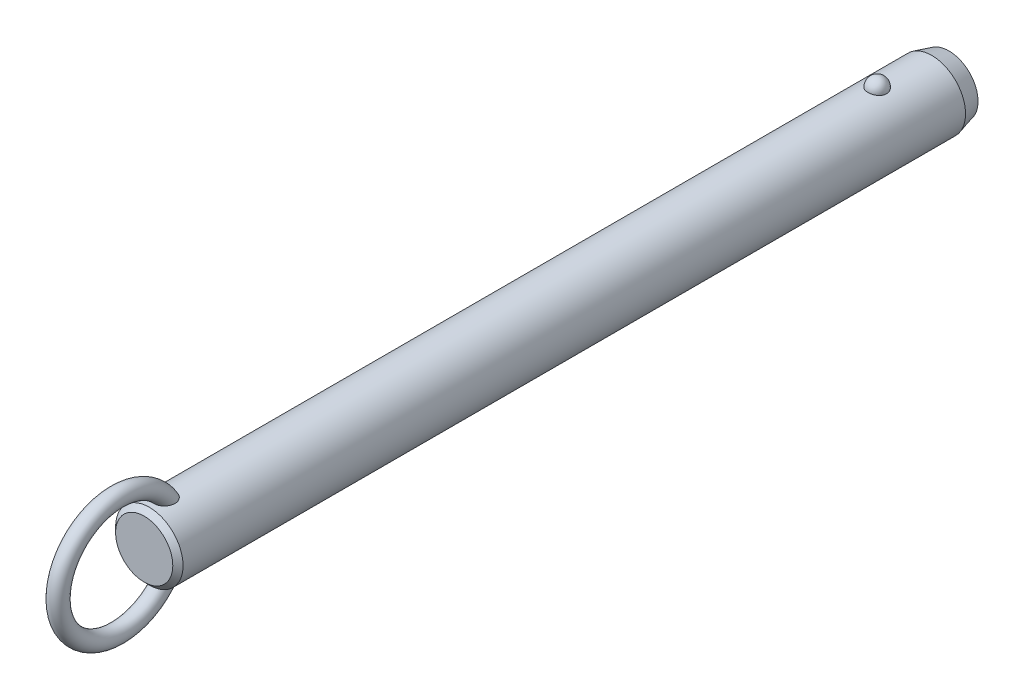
SolidWorks part; units mm, degrees
ref_plane "Front Plane" through (0, 0, 0) normal (0, 0, 1) x (1, 0, 0)
ref_plane "Top Plane" through (0, 0, 0) normal (0, 1, 0) x (1, 0, 0)
ref_plane "Right Plane" through (0, 0, 0) normal (1, 0, 0) x (0, 0, -1)
sketch "Sketch2" plane through (0, 0, 0) normal (0, 0, 1) x (1, 0, 0)
  circle A0 centre (0, 0) radius 7.9
  point P3 (0, 7.9)
  dimension "D1" = 15.8
extrude "Boss-Extrude1" add sketch "Sketch2" along normal blind 160
sketch "Sketch3" plane through (0, 0, 0) normal (0, 0, -1) x (-1, 0, 0)
  circle A0 centre (0, 0) radius 7.9
  dimension "D1" = 15.8
extrude "Boss-Extrude2" add sketch "Sketch3" along normal blind 19
chamfer "Chamfer1" distance 4 angle 15 1 edges at (-7.9, 0, -19)
sketch "Sketch12" plane through (0, 0, 0) normal (1, 0, 0) x (0, 0, -1)
  line L0 (-160, 7.9) -> (-160, -7.9) construction
  point P0 (-160, 0)
sketch "Sketch13" plane through (0, 0, 0) normal (1, 0, 0) x (0, 0, -1)
  circle A0 centre (-175.85, 0) radius 15.85
  point P2 (-160, 0)
  dimension "D1" = 31.7
sketch "Sketch14" plane through (0, 0, 0) normal (0, 1, 0) x (1, 0, 0)
  circle A0 centre (0, -162) radius 2
  point P2 (0, -160)
  dimension "D1" = 4
sweep "Sweep1" add profiles "Sketch14" path "Sketch13"
sketch "Sketch15" plane through (0, 0, 160) normal (0, 0, 1) x (1, 0, 0)
  circle A0 centre (0, 0) radius 7.9
  dimension "D1" = 15.8
extrude "Boss-Extrude3" add sketch "Sketch15" along normal blind 9.52
chamfer "Chamfer2" distance 1.2 angle 45 1 edges at (7.9, 0, 169.52)
sketch "Sketch18" plane through (0, 0, 0) normal (1, 0, 0) x (0, 0, -1)
  line L0 (15, 7.9) -> (-162.1091, 7.9) construction
  line L1 (2.2, 10.1) -> (2.2, 5.7)
  line L2 (-162.1091, -7.9) -> (15, -7.9) construction
  arc A0 (2.2, 10.1) -> (2.2, 5.7) centre (2.2, 7.9) ccw
  point P4 (0, 7.9)
  dimension "D1" = 18
revolve "Revolve1" add sketch "Sketch18" angle 360 about L1
